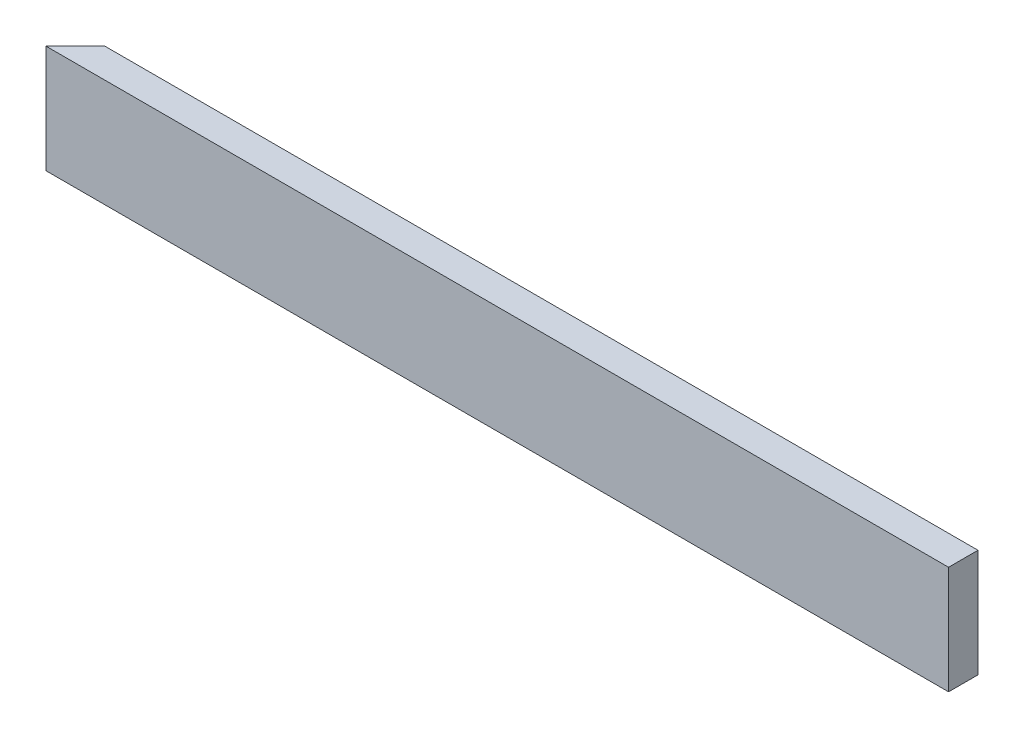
SolidWorks part; units mm, degrees
ref_plane "Front Plane" through (0, 0, 0) normal (0, 0, 1) x (1, 0, 0)
ref_plane "Top Plane" through (0, 0, 0) normal (0, 1, 0) x (1, 0, 0)
ref_plane "Right Plane" through (0, 0, 0) normal (1, 0, 0) x (0, 0, -1)
sketch "Sketch2" plane through (0, 0, 0) normal (0, 1, 0) x (1, 0, 0)
  line L0 (0, 0) -> (0, -38.1)
  line L1 (0, -38.1) -> (-1168.4, -38.1)
  line L2 (-1168.4, -38.1) -> (-1130.3, 0)
  line L3 (-1130.3, 0) -> (0, 0)
extrude "Boss-Extrude1" add sketch "Sketch2" along normal blind 139.7
equation "\"system_width\"= 7ft + 10 "
equation "\"system_length\"= 95.5"
equation "\"module_board_length\"= 11.25in"
equation "\"module_board_width\"= 1.5in"
equation "\"step_board_length\"= 5.5in"
equation "\"step_board_width\"= 1.5in"
equation "\"module_lip_width\"= 1.5in"
equation "\"module_trim_thickness\"= 1in"
equation "\"module_width\"= (\"system_width\" -  2* \"module_trim_thickness\") / 2"
equation "\"module_board_short_depth\"= \"module_width\" - ( 2 * \"module_board_width\" ) - \"module_lip_width\""
equation "\"module_board_hole\"= 0.5in"
equation "\"module_board_hole_seperation\"= 20in"
equation "\"system_step_length\"= 2ft+11.5"
equation "\"system_top_length\"= \"system_length\" - \"system_step_length\""
equation "\"module_top_thickness\"= 0.75in"
equation "\"module_trim_height\"= 14in"
equation "\"module_top_overhang\"= 4.5in"
equation "\"module_trim_angle\"= 45deg"
equation "\"module_length\"= (\"system_top_length\" - \"module_trim_thickness\")/ 2"
equation "\"module_board_long_depth\"= \"module_length\" - \"module_lip_width\""
equation "\"module_board_hole_position\"= ( ( \"module_width\" - \"module_board_hole_seperation\" ) / 2 ) + \"module_board_width\"/2"
equation "\"step_module_width\"= \"module_width\""
equation "\"step_module_length\"= \"system_step_length\" - \"module_trim_thickness\""
equation "\"step_board_short_depth\"= \"step_module_length\" - \"module_lip_width\""
equation "\"step_board_long_depth\"= \"step_module_width\" - (2 * \"module_board_width\") - \"module_lip_width\""
equation "\"D1@Sketch2\"=\"step_module_width\""
equation "\"D2@Sketch2\"=\"step_board_width\""
equation "\"D1@Boss-Extrude1\"=\"step_board_length\""
